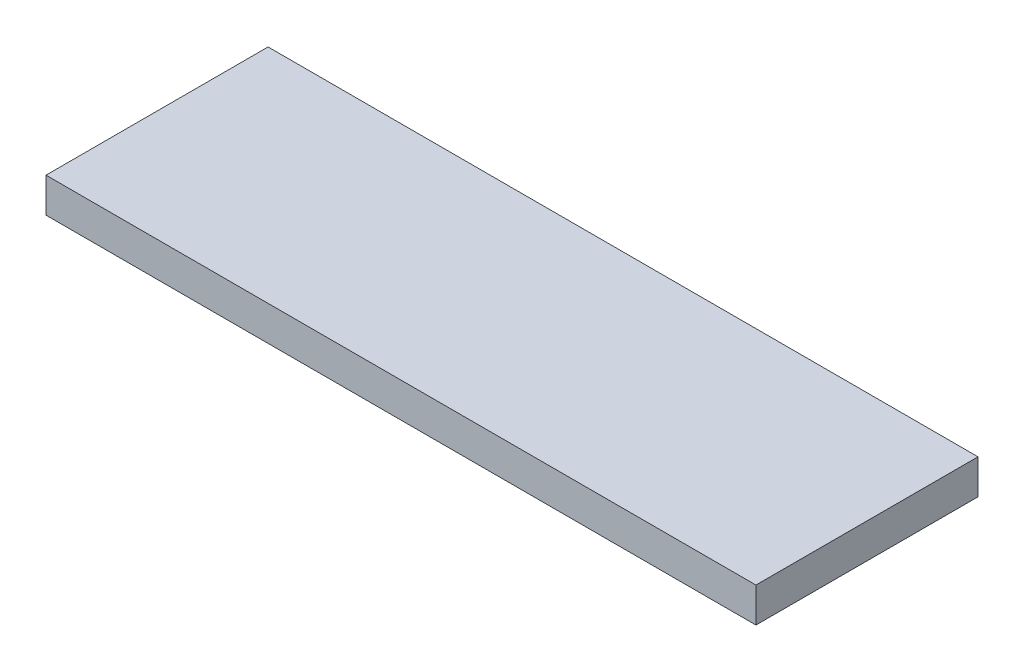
SolidWorks part; units mm, degrees
ref_plane "Front Plane" through (0, 0, 0) normal (1, 0, 0) x (0, 1, 0)
ref_plane "Top Plane" through (0, 0, 0) normal (0, 0, 1) x (0, 1, 0)
ref_plane "Right Plane" through (0, 0, 0) normal (0, 1, 0) x (-1, 0, 0)
sketch "sk w193" plane through (0, 0, 0) normal (0, 0, 1) x (0, 1, 0)
  point P0 (-399.034, -196.596)
  point P3 (-188.214, 0)
  line B0 (-399.034, -196.596) -> (-399.034, -160.02)
  line B1 (-399.034, -160.02) -> (-226.06, -160.02)
  line B2 (-210.82, -144.78) -> (-210.82, 144.78)
  line B3 (-226.06, 160.02) -> (-399.034, 160.02)
  line B4 (-399.034, 160.02) -> (-399.034, 196.596)
  line B5 (-399.034, 196.596) -> (0, 196.596)
  line B6 (0, 196.596) -> (0, 160.02)
  line B7 (0, 160.02) -> (-172.974, 160.02)
  line B8 (-188.214, 144.78) -> (-188.214, -144.78)
  line B9 (-172.974, -160.02) -> (0, -160.02)
  line B10 (0, -160.02) -> (0, -196.596)
  line B11 (0, -196.596) -> (-399.034, -196.596)
  arc B12 (-226.06, -160.02) -> (-210.82, -144.78) centre (-226.06, -144.78) ccw
  arc B13 (-210.82, 144.78) -> (-226.06, 160.02) centre (-226.06, 144.78) ccw
  arc B14 (-172.974, 160.02) -> (-188.214, 144.78) centre (-172.974, 144.78) ccw
  arc B15 (-188.214, -144.78) -> (-172.974, -160.02) centre (-172.974, -144.78) ccw
sketch_block_instance "w14x193-1-1"
sketch_block "w14x193-1" parameters "D4"=15.24, "D1"=399.034, "D2"=393.192, "D3"=22.606, "D5"=36.576
sketch "Sketch2" plane through (0, 0, 0) normal (0, 0, 1) x (0, 1, 0)
  line L0 (320, 501.4782) -> (320, -809.7231)
  line L1 (-188.214, 144.78) -> (-188.214, -144.78)
  line L2 (-188.214, -144.78) -> (-172.974, -160.02)
  line L3 (-172.974, -160.02) -> (5, -160.02)
  line L4 (-188.214, 144.78) -> (-172.974, 160.02)
  line L5 (-172.974, 160.02) -> (5, 160.02)
  line L6 (5, 201.596) -> (5, 160.02)
  line L7 (0, 196.596) -> (0, 160.02) construction
  line L8 (5, -160.02) -> (5, -201.596)
  line L9 (-285.82, 201.596) -> (5, 201.596)
  line L10 (-285.82, -201.596) -> (5, -201.596)
  line L11 (-285.82, 201.596) -> (-285.82, 239.696)
  line L12 (-285.82, 239.696) -> (167.6, 501.4782)
  line L13 (-285.82, -201.596) -> (-285.82, -239.696)
  line L14 (-285.82, -239.696) -> (167.6, -809.7231)
  line L15 (-210.82, -144.78) -> (-210.82, 144.78) construction
  line L16 (-399.034, 196.596) -> (0, 196.596) construction
  line L17 (0, -196.596) -> (-399.034, -196.596) construction
  line L18 (320, 501.4782) -> (167.6, 501.4782)
  line L19 (320, -809.7231) -> (167.6, -809.7231)
  point P30 (320, 501.4782)
  point P31 (320, -809.7231)
  dimension "D1" = 320
  dimension "D2" = 5
  dimension "D3" = 75
  dimension "D4" = 5
  dimension "D5" = 5
  dimension "D6" = 30
  dimension "D7" = 51.5
  dimension "D8" = 38.1
  dimension "D9" = 38.1
  dimension "D10" = 152.4
sketch "Sketch3" plane through (0, 0, 0) normal (0, 1, 0) x (-1, 0, 0)
  line L6 (-195, 61) -> (195, 61)
  line L7 (-195, 61) -> (-195, -61)
  line L8 (-195, -61) -> (195, -61)
  line L9 (195, 61) -> (195, -61)
  point P4 (0, 61)
  point P5 (195, 0)
  dimension "D1" = 122
  dimension "D2" = 390
extrude "Boss-Extrude1" add sketch "Sketch3" along normal blind 19.05
chamfer "Chamfer1" [suppressed] distance 15 angle 30
